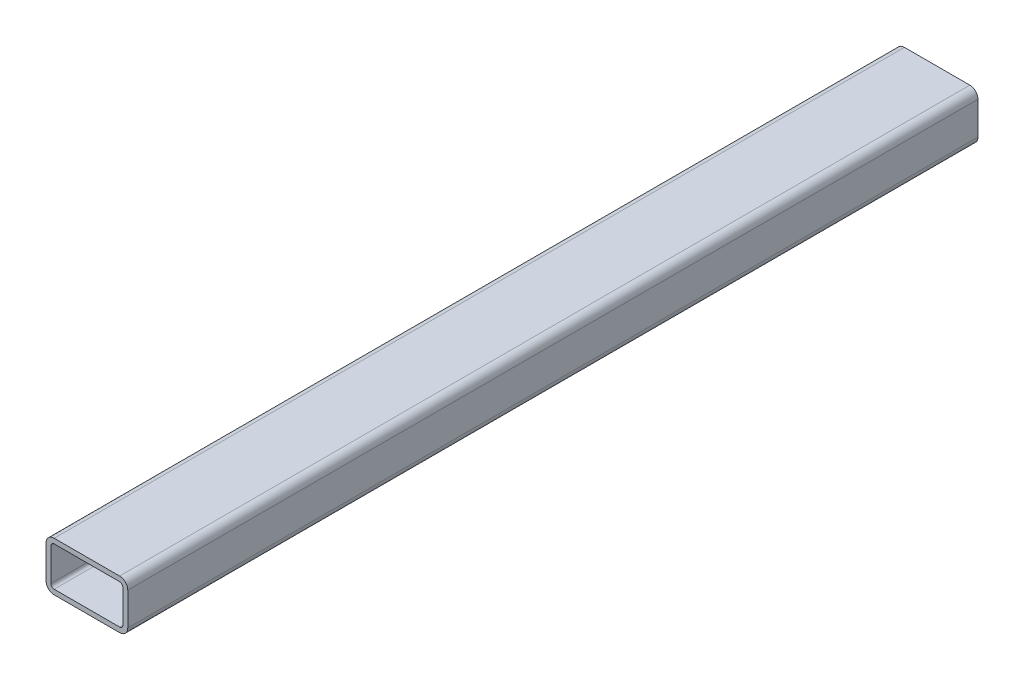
SolidWorks part; units mm, degrees
ref_plane "Plan de face" through (0, 0, 0) normal (0, 0, 1) x (1, 0, 0)
ref_plane "Plan de dessus" through (0, 0, 0) normal (0, 1, 0) x (1, 0, 0)
ref_plane "Plan de droite" through (0, 0, 0) normal (1, 0, 0) x (0, 0, -1)
sketch "Esquisse1" plane through (0, 0, 0) normal (0, 0, 1) x (1, 0, 0)
  line L0 (-10, 6) -> (10, 6)
  line L1 (-10, 7.5) -> (10, 7.5)
  line L2 (-12.5, 5) -> (-12.5, -5)
  line L3 (-10, -7.5) -> (10, -7.5)
  line L4 (12.5, 5) -> (12.5, -5)
  line L5 (-12.5, 7.5) -> (12.5, -7.5) construction
  line L6 (-12.5, -7.5) -> (12.5, 7.5) construction
  line L7 (11, 5) -> (11, -5)
  line L8 (-10, -6) -> (10, -6)
  line L9 (-11, 5) -> (-11, -5)
  arc A0 (-12.5, -5) -> (-10, -7.5) centre (-10, -5) ccw
  arc A1 (10, -7.5) -> (12.5, -5) centre (10, -5) ccw
  arc A2 (10, 7.5) -> (12.5, 5) centre (10, 5) cw
  arc A3 (-10, 7.5) -> (-12.5, 5) centre (-10, 5) ccw
  arc A4 (10, 6) -> (11, 5) centre (10, 5) cw
  arc A5 (10, -6) -> (11, -5) centre (10, -5) ccw
  arc A6 (-11, -5) -> (-10, -6) centre (-10, -5) ccw
  arc A7 (-10, 6) -> (-11, 5) centre (-10, 5) ccw
  point P0 (0, 0)
  dimension "D1" = 2.5
  dimension "D2" = 15
  dimension "D3" = 25
  dimension "D4" = 1.5
extrude "Boss.-Extru.1" add sketch "Esquisse1" along normal mid plane 260
